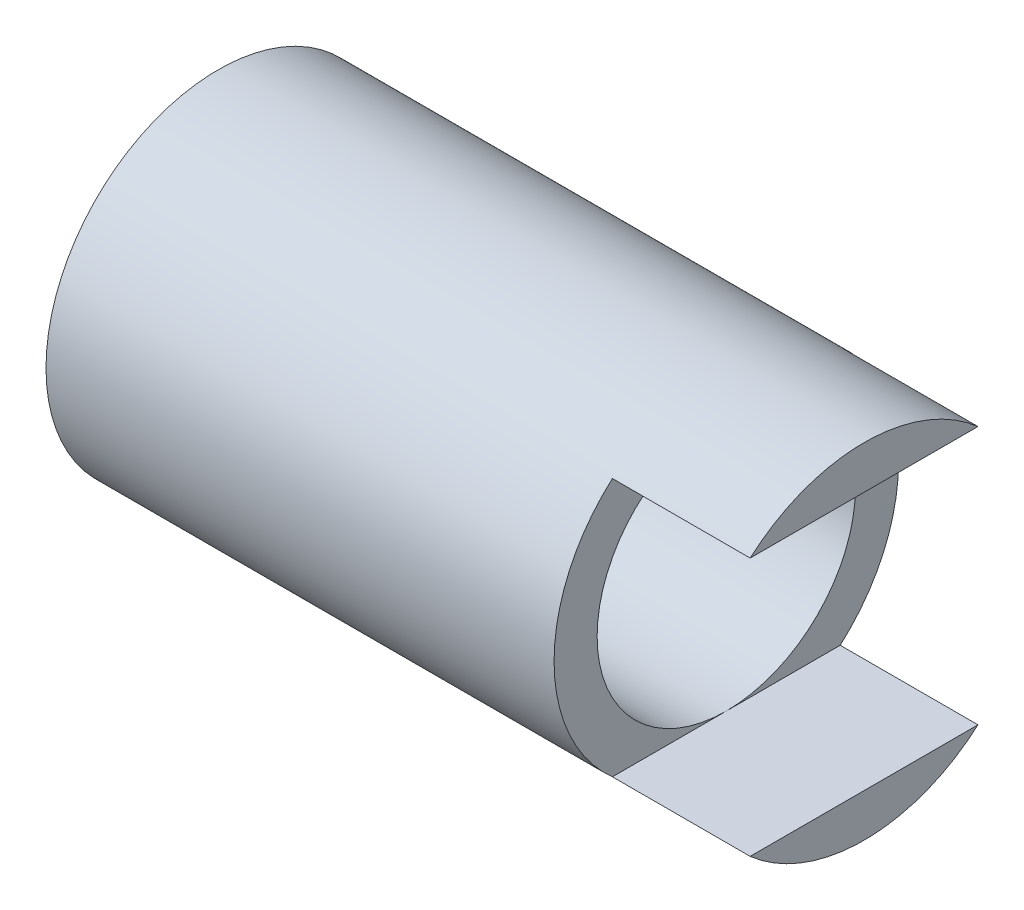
SolidWorks part; units mm, degrees
ref_plane "Front Plane" through (0, 0, 0) normal (0, 0, 1) x (1, 0, 0)
ref_plane "Top Plane" through (0, 0, 0) normal (0, 1, 0) x (1, 0, 0)
ref_plane "Right Plane" through (0, 0, 0) normal (1, 0, 0) x (0, 0, -1)
sketch "Sketch1" plane through (0, 0, 0) normal (0, 0, 1) x (1, 0, 0)
  line L0 (-6.9009, 0) -> (19.9897, 0) construction
  line L2 (0, 3) -> (15, 3)
  line L3 (15, 3) -> (15, 4)
  line L4 (15, 4) -> (0, 4)
  line L5 (0, 4) -> (0, 3)
  dimension "D1" = 4
  dimension "D2" = 15
  dimension "D3" = 3
revolve "Revolve1" add sketch "Sketch1" angle 360 about L0
sketch "Sketch2" plane through (15, 0, 0) normal (1, 0, 0) x (0, 0, -1)
  line L1 (5, -3) -> (-5, -3)
  line L2 (5, -3) -> (5, 3)
  line L3 (5, 3) -> (-5, 3)
  line L4 (-5, -3) -> (-5, 3)
  line L5 (5, -3) -> (-5, 3) construction
  line L6 (5, 3) -> (-5, -3) construction
  point P0 (0, 0)
  dimension "D1" = 6
  dimension "D2" = 10
extrude "Cut-Extrude1" cut sketch "Sketch2" against normal blind 3.2
sketch "Sketch3" plane through (0, 0, 0) normal (0, 0, 1) x (1, 0, 0)
  line L0 (0, 1) -> (6.5, 1)
  line L1 (0, 3) -> (0, -3) construction
  line L2 (6.5, -1) -> (0, -1)
  line L3 (0, -1) -> (0, 1)
  arc A0 (6.5, 1) -> (6.5, -1) centre (6.5, 0) cw
  dimension "D1" = 2
  dimension "D2" = 1
  dimension "D3" = 6.5
extrude "Cut-Extrude2" cut sketch "Sketch3" against normal through all
